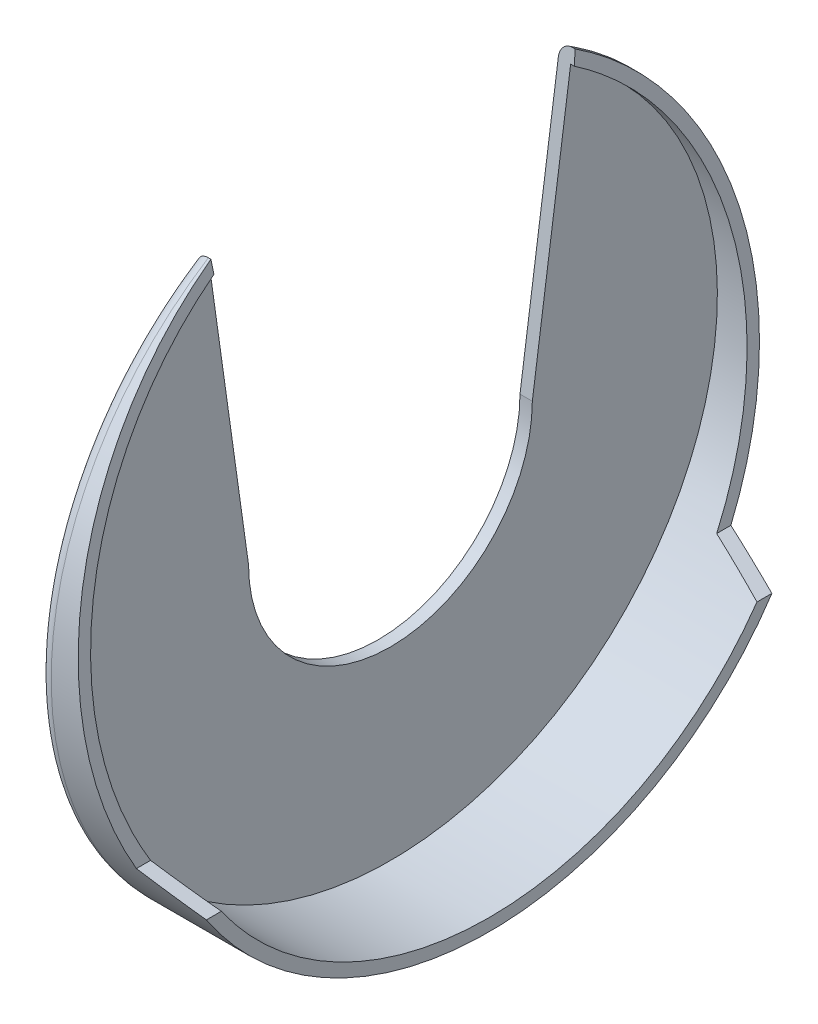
SolidWorks part; units mm, degrees
ref_plane "Front Plane" through (0, 0, 0) normal (0, 0, 1) x (1, 0, 0)
ref_plane "Top Plane" through (0, 0, 0) normal (0, 1, 0) x (1, 0, 0)
ref_plane "Right Plane" through (0, 0, 0) normal (1, 0, 0) x (0, 0, -1)
sketch "Sketch1" plane through (0, 0, 0) normal (1, 0, 0) x (0, 0, -1)
  line L0 (11.5, 0) -> (14.7609, 23.2027)
  line L1 (0, 0) -> (0, 53.6567) construction
  line L2 (-11.5, 0) -> (-14.7609, 23.2027)
  arc A0 (-14.7609, 23.2027) -> (14.7609, 23.2027) centre (0, 0) ccw
  arc A1 (-11.5, 0) -> (11.5, 0) centre (0, 0) ccw
  dimension "D1" = 55
  dimension "D2" = 23
  dimension "D3" = 8
extrude "Boss-Extrude1" add sketch "Sketch1" along normal blind 9
sketch "Sketch2" plane through (0, 0, 0) normal (0, 0, 1) x (1, 0, 0)
  line L0 (1.2029, 23.2027) -> (4.5, -13.2602)
  line L1 (9, 23.2027) -> (0, 23.2027) construction
  line L2 (4.5, -13.2602) -> (9, -15.1984)
  line L3 (9, -27.5) -> (9, 23.2027) construction
extrude "Cut-Extrude1" cut sketch "Sketch2" against normal through all and the other way through all
fillet "Fillet1" radius 1 1 edges at (0, -27.5, 0)
shell "Shell1" thickness 1
